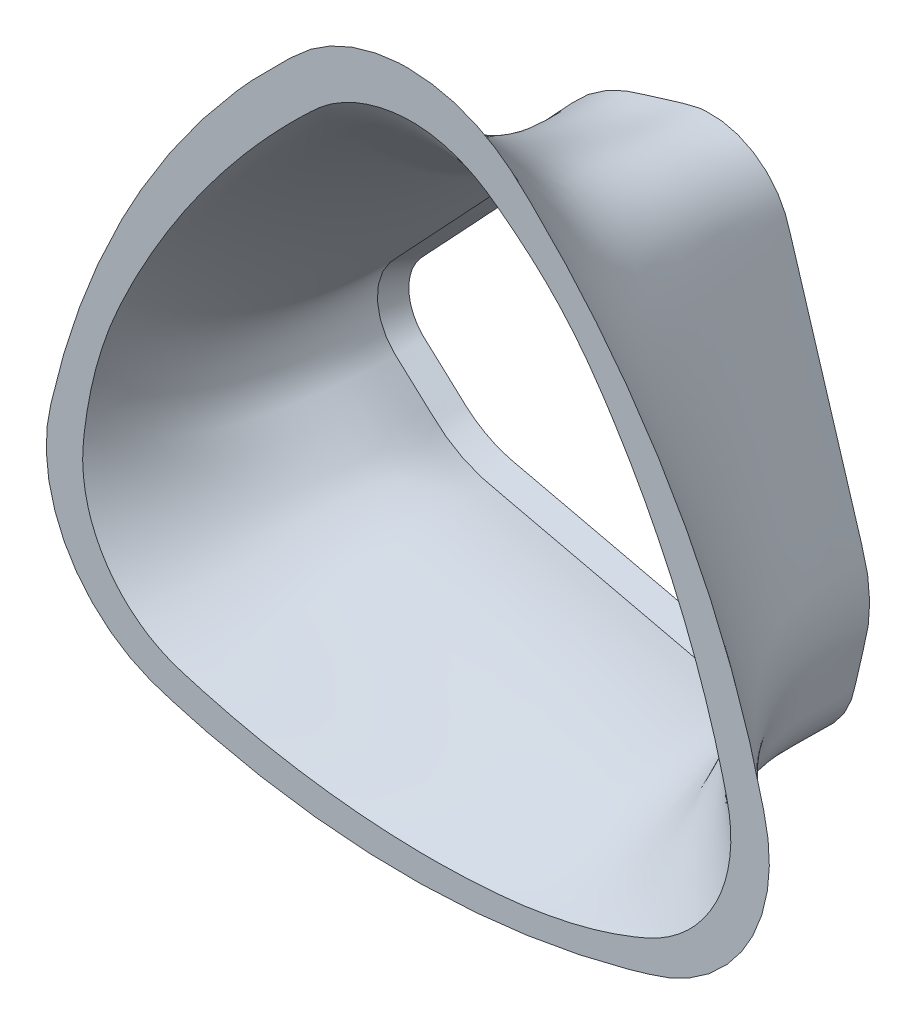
SolidWorks part; units mm, degrees
ref_plane "Plan de face" through (0, 0, 0) normal (0, 0, 1) x (1, 0, 0)
ref_plane "Plan de dessus" through (0, 0, 0) normal (0, 1, 0) x (1, 0, 0)
ref_plane "Plan de droite" through (0, 0, 0) normal (1, 0, 0) x (0, 0, -1)
ref_plane "Plan1" through (0, 0, 110) normal (0, 0, 1) x (1, 0, 0)
ref_plane "Plan7" through (0, 0, 114) normal (0, 0, 1) x (1, 0, 0)
ref_plane "Plan2" through (0, 0, 10) normal (0, 0, 1) x (1, 0, 0)
ref_plane "Plan3" through (38.9793, 11.9172, 0) normal (-0.9563, -0.2924, 0) x (0, 0, 1)
ref_plane "Plan4" through (75.3189, 23.0273, 0) normal (0.9563, 0.2924, 0) x (0, 0, -1)
ref_plane "Plan5" through (0, 0, 93.2) normal (0, 0, 1) x (1, 0, 0)
sketch "Esquisse8" plane through (0, 0, 93.2) normal (0, 0, 1) x (1, 0, 0)
  line L0 (-6.3586, 133.1593) -> (-21.6047, 116.8099)
  line L1 (-21.2592, 106.9164) -> (-17.8152, 103.7049)
  line L2 (-12.3306, 100.7887) -> (9.4514, 95.7599)
  line L3 (17.8467, 101.0058) -> (18.906, 105.5941)
  line L4 (18.6892, 111.802) -> (12.1532, 133.1802)
  line L12 (3.4125, 137.8278) -> (-1.0908, 136.451)
  line L15 (-19.1909, 80.8201) -> (-19.7983, 78.1893)
  line L16 (-19.7983, 78.1893) -> (-14.2678, 76.9125)
  line L17 (-14.2678, 76.9125) -> (-14.5731, 75.59)
  line L18 (-13.5987, 75.365) -> (-13.2934, 76.6875)
  line L19 (-13.2934, 76.6875) -> (13.0146, 70.6139)
  line L20 (13.0146, 70.6139) -> (19.4032, 98.286)
  line L21 (19.4032, 98.286) -> (15.3806, 99.2147)
  line L22 (15.3806, 99.2147) -> (16.9572, 106.044)
  line L23 (16.7766, 111.2173) -> (8.7788, 137.377)
  line L24 (8.7788, 137.377) -> (-0.506, 134.5384)
  line L25 (-4.8959, 131.7953) -> (-23.5519, 111.7891)
  line L26 (-23.5519, 111.7891) -> (-16.4512, 105.1676)
  line L27 (-11.8807, 102.7374) -> (13.6235, 96.8493)
  line L28 (13.6235, 96.8493) -> (8.4497, 74.4388)
  line L29 (8.4497, 74.4388) -> (-19.1909, 80.8201)
  line L37 (15.8979, 101.4557) -> (16.9572, 106.044)
  line L38 (16.7766, 111.2173) -> (10.2406, 132.5955)
  line L39 (3.9972, 135.9152) -> (-0.506, 134.5384)
  line L40 (-4.8959, 131.7953) -> (-20.142, 115.4459)
  line L41 (-19.8952, 108.3791) -> (-16.4512, 105.1676)
  line L42 (-11.8807, 102.7374) -> (9.9013, 97.7086)
  arc A0 (-20.142, 115.4459) -> (-19.8952, 108.3791) centre (-16.4852, 112.0359) ccw
  arc A1 (9.9013, 97.7086) -> (15.8979, 101.4557) centre (11.0261, 102.5805) ccw
  arc A2 (10.2406, 132.5955) -> (3.9972, 135.9152) centre (5.4591, 131.1336) ccw
  arc A3 (-21.6047, 116.8099) -> (-21.2592, 106.9164) centre (-16.4852, 112.0359) ccw
  arc A4 (-14.5731, 75.59) -> (-13.5987, 75.365) centre (-14.9076, 71.9184) ccw
  arc A5 (16.9572, 106.044) -> (16.7766, 111.2173) centre (7.2135, 108.2936) ccw
  arc A6 (-0.506, 134.5384) -> (-4.8959, 131.7953) centre (2.4177, 124.9753) ccw
  arc A7 (-16.4512, 105.1676) -> (-11.8807, 102.7374) centre (-9.6312, 112.4811) ccw
  arc A8 (-17.8152, 103.7049) -> (-12.3306, 100.7887) centre (-9.6312, 112.4811) ccw
  arc A9 (16.9572, 106.044) -> (16.7766, 111.2173) centre (7.2135, 108.2936) ccw
  arc A10 (-0.506, 134.5384) -> (-4.8959, 131.7953) centre (2.4177, 124.9753) ccw
  arc A11 (-16.4512, 105.1676) -> (-11.8807, 102.7374) centre (-9.6312, 112.4811) ccw
  arc A12 (9.4514, 95.7599) -> (17.8467, 101.0058) centre (11.0261, 102.5805) ccw
  arc A13 (18.906, 105.5941) -> (18.6892, 111.802) centre (7.2135, 108.2936) ccw
  arc A14 (12.1532, 133.1802) -> (3.4125, 137.8278) centre (5.4591, 131.1336) ccw
  arc A15 (-1.0908, 136.451) -> (-6.3586, 133.1593) centre (2.4177, 124.9753) ccw
  dimension "D2" = 5
  dimension "D1" = 0
ref_plane "Plan6" through (0, 0, 98.2) normal (0, 0, 1) x (1, 0, 0)
sketch "Esquisse11" plane through (0, 0, 98.2) normal (0, 0, 1) x (1, 0, 0)
  line L0 (16.7766, 111.2173) -> (10.2406, 132.5955) construction
  line L1 (16.7766, 111.2173) -> (10.2406, 132.5955)
  line L2 (3.9972, 135.9152) -> (-0.506, 134.5384) construction
  line L3 (-4.8959, 131.7953) -> (-20.142, 115.4459) construction
  line L4 (-19.8952, 108.3791) -> (-16.4512, 105.1676) construction
  line L5 (-11.8807, 102.7374) -> (9.9013, 97.7086) construction
  line L6 (15.8979, 101.4557) -> (16.9572, 106.044) construction
  line L7 (3.9972, 135.9152) -> (-0.506, 134.5384)
  line L8 (-4.8959, 131.7953) -> (-20.142, 115.4459)
  line L9 (-19.8952, 108.3791) -> (-16.4512, 105.1676)
  line L10 (-11.8807, 102.7374) -> (9.9013, 97.7086)
  line L11 (15.8979, 101.4557) -> (16.9572, 106.044)
  line L12 (-6.3586, 133.1593) -> (-21.6047, 116.8099)
  line L13 (-21.2592, 106.9164) -> (-17.8152, 103.7049)
  line L14 (-12.3306, 100.7887) -> (9.4514, 95.7599)
  line L15 (17.8467, 101.0058) -> (18.906, 105.5941)
  line L16 (18.6892, 111.802) -> (12.1532, 133.1802)
  line L21 (3.4125, 137.8278) -> (-1.0908, 136.451)
  arc A0 (10.2406, 132.5955) -> (3.9972, 135.9152) centre (5.4591, 131.1336) ccw construction
  arc A1 (-0.506, 134.5384) -> (-4.8959, 131.7953) centre (2.4177, 124.9753) ccw construction
  arc A2 (-20.142, 115.4459) -> (-19.8952, 108.3791) centre (-16.4852, 112.0359) ccw construction
  arc A3 (-16.4512, 105.1676) -> (-11.8807, 102.7374) centre (-9.6312, 112.4811) ccw construction
  arc A4 (9.9013, 97.7086) -> (15.8979, 101.4557) centre (11.0261, 102.5805) ccw construction
  arc A5 (16.9572, 106.044) -> (16.7766, 111.2173) centre (7.2135, 108.2936) ccw construction
  arc A6 (10.2406, 132.5955) -> (3.9972, 135.9152) centre (5.4591, 131.1336) ccw
  arc A7 (-0.506, 134.5384) -> (-4.8959, 131.7953) centre (2.4177, 124.9753) ccw
  arc A8 (-20.142, 115.4459) -> (-19.8952, 108.3791) centre (-16.4852, 112.0359) ccw
  arc A9 (-16.4512, 105.1676) -> (-11.8807, 102.7374) centre (-9.6312, 112.4811) ccw
  arc A10 (9.9013, 97.7086) -> (15.8979, 101.4557) centre (11.0261, 102.5805) ccw
  arc A11 (16.9572, 106.044) -> (16.7766, 111.2173) centre (7.2135, 108.2936) ccw
  arc A12 (-21.6047, 116.8099) -> (-21.2592, 106.9164) centre (-16.4852, 112.0359) ccw
  arc A13 (-17.8152, 103.7049) -> (-12.3306, 100.7887) centre (-9.6312, 112.4811) ccw
  arc A14 (9.4514, 95.7599) -> (17.8467, 101.0058) centre (11.0261, 102.5805) ccw
  arc A15 (18.906, 105.5941) -> (18.6892, 111.802) centre (7.2135, 108.2936) ccw
  arc A16 (12.1532, 133.1802) -> (3.4125, 137.8278) centre (5.4591, 131.1336) ccw
  arc A17 (-1.0908, 136.451) -> (-6.3586, 133.1593) centre (2.4177, 124.9753) ccw
sketch "Esquisse13" plane through (0, 0, 114) normal (0, 0, 1) x (1, 0, 0)
  arc A0 (9.4618, 145.5686) -> (-9.4618, 145.5686) centre (0, 135.25) ccw
  arc A1 (-9.4618, 145.5686) -> (-30.9876, 108.2849) centre (38.9711, 92.75) ccw
  arc A2 (-30.9876, 108.2849) -> (-21.5258, 91.8965) centre (-17.3205, 105.25) ccw
  arc A3 (-21.5258, 91.8965) -> (21.5258, 91.8965) centre (0, 160.25) ccw
  arc A4 (21.5258, 91.8965) -> (30.9876, 108.2849) centre (17.3205, 105.25) ccw
  arc A5 (30.9876, 108.2849) -> (9.4618, 145.5686) centre (-38.9711, 92.75) ccw
  arc A6 (8.1102, 144.0945) -> (-8.1102, 144.0945) centre (0, 135.25) ccw
  arc A7 (-8.1102, 144.0945) -> (-29.0352, 107.8513) centre (38.9711, 92.75) ccw
  arc A8 (-29.0352, 107.8513) -> (-20.925, 93.8041) centre (-17.3205, 105.25) ccw
  arc A9 (-20.925, 93.8041) -> (20.925, 93.8041) centre (0, 160.25) ccw
  arc A10 (20.925, 93.8041) -> (29.0352, 107.8513) centre (17.3205, 105.25) ccw
  arc A11 (29.0352, 107.8513) -> (8.1102, 144.0945) centre (-38.9711, 92.75) ccw
sketch "Esquisse14" plane through (0, 0, 0) normal (1, 0, 0) x (0, 0, -1)
  line L0 (-98.2, 23.6253) -> (-98.2, -23.6253) construction
  line L1 (-93.2, 23.6253) -> (-93.2, -23.6253) construction
  line L16 (-114, 23.4042) -> (-114, -23.4042) construction
  spline S1 degree 2 poles (-93.2, 136.7845) (-106.3, 135.236) (-114, 149.25) knots 0 0 0 1 1 1
loft "Lissage3" add
shell "Coque14" thickness 2
sketch "Esquisse17" plane through (0, 0, 95.2) normal (0, 0, 1) x (1, 0, 0)
  spline S1 degree 3 number of poles 146 (4.4075, 99.0076) -> (4.4075, 99.0076)
  spline S2 degree 3 number of poles 146 (4.4075, 99.0076) -> (4.4075, 99.0076)
  dimension "D1" = 0
extrude "Enlèv. mat.-Extru.6" cut sketch "Esquisse17" against normal blind 10 draft 20
